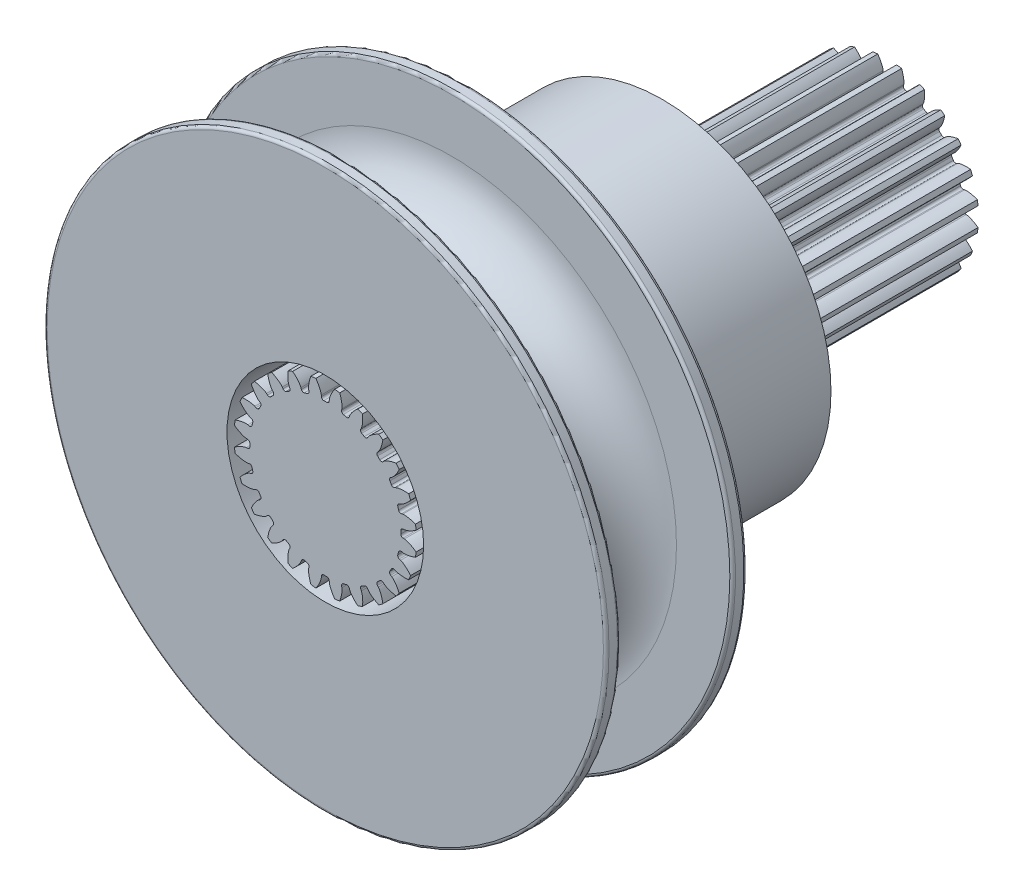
SolidWorks part; units mm, degrees
ref_plane "Front Plane" through (0, 0, 0) normal (0, 0, 1) x (1, 0, 0)
ref_plane "Top Plane" through (0, 0, 0) normal (0, 1, 0) x (1, 0, 0)
ref_plane "Right Plane" through (0, 0, 0) normal (1, 0, 0) x (0, 0, -1)
sketch "Sketch1" plane through (0, 0, 0) normal (0, 0, 1) x (1, 0, 0)
  line L0 (0, 0) -> (0, 19.05) construction
  line L1 (-6.1226, 21.2784) -> (6.1226, 16.8216) construction
  circle A0 centre (0, 0) radius 17.0656 construction
  circle A1 centre (0, 0) radius 20.6375 construction
  circle A2 centre (0, 0) radius 19.05 construction
  circle A3 centre (0, 0) radius 17.9011 construction
  point P8 (203.2, 0)
  point P13 (304.8, 0)
sketch "Sketch2" plane through (0, 0, 0) normal (1, 0, 0) x (0, 0, -1)
  line L0 (-152.4, 0) -> (152.4, 0) construction
  point P2 (-131.7625, 0)
  point P5 (-121.4438, 0)
  point P6 (131.7625, 0)
sketch "Sketch3" plane through (0, 0, 0) normal (0, 0, 1) x (1, 0, 0)
  circle A0 centre (0, 0) radius 20.6375
  circle A1 centre (0, 0) radius 20.6375 construction
extrude "Boss-Extrude1" add sketch "Sketch3" against normal up to vertex and the other way up to vertex
sketch "Sketch4" plane through (0, 0, 0) normal (0, 0, 1) x (1, 0, 0)
  line L0 (0, 0) -> (17.0438, 0.8622) construction
  line L2 (0, 0) -> (17.0438, -0.8622) construction
  line L4 (17.0438, 0.8622) -> (17.8783, 0.9044)
  line L5 (17.8783, -0.9044) -> (17.0438, -0.8622)
  arc A0 (17.0438, 0.8622) -> (17.0438, -0.8622) centre (0, 0) cw
  arc A3 (20.5273, 2.1297) -> (20.5273, -2.1297) centre (0, 0) cw
  circle A4 centre (0, 0) radius 20.6375 construction
  spline S0 degree 4 poles (17.8783, 0.9044) (17.8826, 0.9047) (17.8948, 0.9056) (17.9178, 0.908) (17.9552, 0.9129) (18.0028, 0.9204) (18.0642, 0.9316) (18.1363, 0.9468) (18.2153, 0.9656) (18.3009, 0.9883) (18.3861, 1.013) (18.4708, 1.0393) (18.5549, 1.0673) (18.6565, 1.1031) (18.7778, 1.1487) (18.9188, 1.2059) (19.0779, 1.2755) (19.2391, 1.3513) (19.3967, 1.43) (19.555, 1.5141) (19.7073, 1.5988) (19.8644, 1.6914) (20.0088, 1.7793) (20.1693, 1.883) (20.2983, 1.9682) (20.4671, 2.0861) (20.5663, 2.1574) (20.6818, 2.2427) (20.7328, 2.2815) (20.7642, 2.3054) knots 0 0 0 0 0 0.005377 0.015084 0.028532 0.04661 0.064855 0.092111 0.119476 0.146842 0.174209 0.201575 0.228941 0.256307 0.307035 0.361767 0.4165 0.471232 0.525964 0.580697 0.635429 0.690161 0.744894 0.799626 0.854358 0.909091 0.954545 1 1 1 1 1 construction
  spline S1 degree 4 poles (17.8783, 0.9044) (17.8826, 0.9047) (17.8948, 0.9056) (17.9178, 0.908) (17.9552, 0.9129) (18.0028, 0.9204) (18.0642, 0.9316) (18.1363, 0.9468) (18.2153, 0.9656) (18.3009, 0.9883) (18.3861, 1.013) (18.4708, 1.0393) (18.5549, 1.0673) (18.6565, 1.1031) (18.7778, 1.1487) (18.9188, 1.2059) (19.0779, 1.2755) (19.2391, 1.3513) (19.3967, 1.43) (19.555, 1.5141) (19.7073, 1.5988) (19.8644, 1.6914) (20.0088, 1.7793) (20.1693, 1.883) (20.2983, 1.9682) (20.4305, 2.0606) (20.4946, 2.1061) (20.5273, 2.1297) knots 0 0 0 0 0 0.005377 0.015084 0.028532 0.04661 0.064855 0.092111 0.119476 0.146842 0.174209 0.201575 0.228941 0.256307 0.307035 0.361767 0.4165 0.471232 0.525964 0.580697 0.635429 0.690161 0.744894 0.799626 0.854358 0.909091 0.909091 0.909091 0.909091 0.909091
  spline S2 degree 4 poles (17.8783, -0.9044) (17.8826, -0.9047) (17.8948, -0.9056) (17.9178, -0.908) (17.9552, -0.9129) (18.0028, -0.9204) (18.0642, -0.9316) (18.1363, -0.9468) (18.2153, -0.9656) (18.3009, -0.9883) (18.3861, -1.013) (18.4708, -1.0393) (18.5549, -1.0673) (18.6565, -1.1031) (18.7778, -1.1487) (18.9188, -1.2059) (19.0779, -1.2755) (19.2391, -1.3513) (19.3967, -1.43) (19.555, -1.5141) (19.7073, -1.5988) (19.8644, -1.6914) (20.0088, -1.7793) (20.1693, -1.883) (20.2983, -1.9682) (20.4671, -2.0861) (20.5663, -2.1574) (20.6818, -2.2427) (20.7328, -2.2815) (20.7642, -2.3054) knots 0 0 0 0 0 0.005377 0.015084 0.028532 0.04661 0.064855 0.092111 0.119476 0.146842 0.174209 0.201575 0.228941 0.256307 0.307035 0.361767 0.4165 0.471232 0.525964 0.580697 0.635429 0.690161 0.744894 0.799626 0.854358 0.909091 0.954545 1 1 1 1 1 construction
  spline S3 degree 4 poles (17.8783, -0.9044) (17.8826, -0.9047) (17.8948, -0.9056) (17.9178, -0.908) (17.9552, -0.9129) (18.0028, -0.9204) (18.0642, -0.9316) (18.1363, -0.9468) (18.2153, -0.9656) (18.3009, -0.9883) (18.3861, -1.013) (18.4708, -1.0393) (18.5549, -1.0673) (18.6565, -1.1031) (18.7778, -1.1487) (18.9188, -1.2059) (19.0779, -1.2755) (19.2391, -1.3513) (19.3967, -1.43) (19.555, -1.5141) (19.7073, -1.5988) (19.8644, -1.6914) (20.0088, -1.7793) (20.1693, -1.883) (20.2983, -1.9682) (20.4305, -2.0606) (20.4946, -2.1061) (20.5273, -2.1297) knots 0 0 0 0 0 0.005377 0.015084 0.028532 0.04661 0.064855 0.092111 0.119476 0.146842 0.174209 0.201575 0.228941 0.256307 0.307035 0.361767 0.4165 0.471232 0.525964 0.580697 0.635429 0.690161 0.744894 0.799626 0.854358 0.909091 0.909091 0.909091 0.909091 0.909091
extrude "Cut-Extrude1" cut sketch "Sketch4" against normal through all both and the other way through all
fillet "Fillet1" radius 0.5326 2 edges at (17.0438, -0.8622, 0) (17.0438, 0.8622, 0)
pattern_circular "CirPattern1" count 24 over 360 about axis through (0, 0, 152.4) along (0, 0, -1) of "Cut-Extrude1", "Fillet1"
sketch "Sketch6" plane through (0, 0, 152.4) normal (0, 0, 1) x (1, 0, 0)
  circle A0 centre (-38.1, 0) radius 673.6155
  circle A1 centre (0, 0) radius 38.1 construction
extrude "Cut-Extrude2" cut sketch "Sketch6" against normal blind 177.8
sketch "Sketch7" plane through (0, 0, -25.4) normal (0, 0, 1) x (1, 0, 0)
  circle A0 centre (0, 0) radius 22.225
  circle A1 centre (0, 0) radius 38.1
  dimension "D1" = 76.2
  dimension "D2" = 44.45
extrude "Boss-Extrude2" add sketch "Sketch7" against normal blind 76.2 separate body
sketch "Sketch8" plane through (0, 0, -25.4) normal (0, 0, 1) x (1, 0, 0)
  circle A0 centre (0, 0) radius 38.1 construction
  circle A1 centre (0, 0) radius 38.1
  circle A2 centre (0, 0) radius 63.5
  dimension "D1" = 25.4
extrude "Boss-Extrude3" add sketch "Sketch8" against normal blind 3.175
ref_plane "Plane1" through (0, 0, -41.275) normal (0, 0, 1) x (1, 0, 0)
mirror "Mirror2" about plane through (0, 0, -41.275) normal (0, 0, 1) of "Boss-Extrude3"
fillet "Fillet2" radius 12.7 3 edges at (38.1, 0, -53.975) (-38.1, 0, -57.15) (38.1, 0, -28.575)
fillet "Fillet3" radius 0.635 4 edges at (63.5, 0, -28.575) (63.5, 0, -53.975) (63.5, 0, -57.15) (63.5, 0, -25.4)
equation "\"Root Diameter@Sketch1\"=\"Root Diameter\""
equation "\"OD | Outside Diameter@Sketch1\"=\"Outside Diameter\""
equation "\"D1@CirPattern1\"=\"Number of Teeth\""
equation "\"Diametral Pitch\"= 16"
equation "\"Number of Teeth\"= 24"
equation "\"Pressure Angle\"=20"
equation "\"Pitch Diameter\"= \"Number of Teeth\" / \"Diametral Pitch\""
equation "\"Base Diameter\"= \"Pitch Diameter\" * cos ( \"Pressure Angle\" )"
equation "\"Outside Diameter\"= ( \"Number of Teeth\" + 2 ) / \"Diametral Pitch\""
equation "\"Dedendum\"= 1.25 / \"Diametral Pitch\""
equation "\"Root Diameter\"= \"Pitch Diameter\" - ( 2 * \"Dedendum\" )"
equation "\"Pitch Angle\"= 360deg / \"Number of Teeth\""
equation "\"Alpha\"= sqr ( \"Pitch Diameter\" ^ 2 - \"Base Diameter\" ^ 2 ) / \"Base Diameter\" * 180 / PI - \"Pressure Angle\""
equation "\"Beta\"= ( \"Pitch Angle\" / 4 - \"Alpha\" )"
equation "\"Phi\"= sqr ( ( \"Outside Diameter\" / 2 ) ^ 2 - ( \"Base Diameter\" / 2 ) ^ 2 ) / ( \"Base Diameter\" / 2 )"
equation "\"Addendum\"= 1 / \"Diametral Pitch\""
equation "\"WorkingDepth\"= 2 / \"Diametral Pitch\""
equation "\"WholeDepth\"= 2.25 / \"Diametral Pitch\""
equation "\"Clearance\"= 0.25 / \"Diametral Pitch\""
equation "\"ToothThickness\"= ( pi * 2 ) / \"Diametral Pitch\""
equation "\"CircularPitch\"= pi / \"Diametral Pitch\""
equation "\"Number of Teeth@Sketch1\"=\"Number of Teeth\""
equation "\"Gear Pitch | Diametral Pitch@Sketch1\"=\"Diametral Pitch\""
equation "\"Pressure Angle@Sketch1\"=\"Pressure Angle\""
equation "\"Gear Pitch Diameter@Sketch1\"=\"Pitch Diameter\""
equation "\"Base Diameter@Sketch1\"=\"Base Diameter\""
equation "\"Fillet\"= \"Clearance\" * cos ( \"Pressure Angle\" ) * tan ( ( 90 + \"Pressure Angle\" ) / 2 )"
equation "\"D1@Fillet1\"=\"Fillet\""
equation "\"D1@Sketch4\"=if( \"Base Diameter\">\"Root Diameter\",\"Root Diameter\",\"Base Diameter\"-.00001)"
equation "\"D1@Sketch2\"=\"OD | Outside Diameter@Sketch1\"*2*0.5*0.5"
equation "\"D2@Sketch2\"=\"D1@Sketch2\"*1.5"
equation "\"D3@Sketch2\"=\"D1@Sketch2\""
